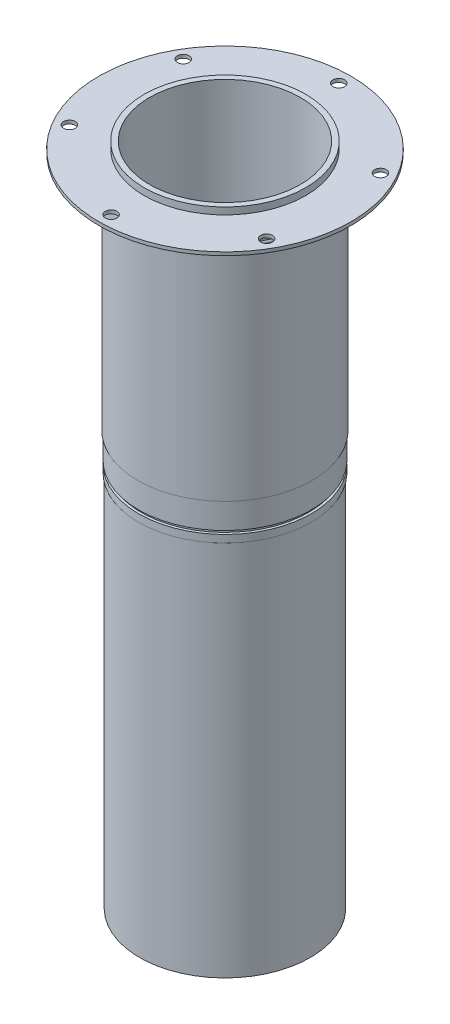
SolidWorks part; units mm, degrees
ref_plane "Front Plane" through (0, 0, 0) normal (0, 0, 1) x (1, 0, 0)
ref_plane "Top Plane" through (0, 0, 0) normal (0, 1, 0) x (1, 0, 0)
ref_plane "Right Plane" through (0, 0, 0) normal (1, 0, 0) x (0, 0, -1)
sketch "Sketch1" plane through (0, 0, 0) normal (0, 0, 1) x (1, 0, 0)
  line L0 (0, 0) -> (0, 40.0271) construction
  line L1 (-23.8125, 0) -> (-37.1348, 0)
  line L2 (-37.1348, 0) -> (-37.1348, -0.9906)
  line L3 (-25.654, -6.35) -> (-25.4, -6.35)
  line L4 (-37.1348, -0.9906) -> (-25.4, -0.9906)
  line L5 (-23.8125, 0) -> (-23.8125, 2.032)
  line L6 (-23.8125, 2.032) -> (-22.225, 2.032)
  line L7 (-22.225, 2.032) -> (-22.225, -193.675)
  line L8 (-22.225, -193.675) -> (-25.146, -193.675)
  line L9 (-25.146, -193.675) -> (-25.146, -82.55)
  line L10 (-25.4, -80.3656) -> (-24.6761, -80.3656)
  line L11 (-24.6761, -80.3656) -> (-24.6761, -79.375)
  line L12 (-24.6761, -79.375) -> (-25.4, -79.375)
  line L13 (-25.146, -82.55) -> (-25.4, -82.55)
  line L14 (-25.4, -82.55) -> (-25.4, -80.3656)
  line L15 (-25.4, -79.375) -> (-25.4, -71.755)
  line L16 (-25.4, -71.755) -> (-25.654, -71.755)
  line L19 (-25.654, -71.755) -> (-25.654, -6.35)
  line L20 (-25.4, -0.9906) -> (-25.4, -6.35)
  dimension "D2" = 6.35
  dimension "D3" = 44.45
  dimension "D4" = 47.625
  dimension "D5" = 2.032
  dimension "D6" = 50.8
  dimension "D7" = 7.62
  dimension "D8" = 50.292
  dimension "D9" = 79.375
  dimension "D10" = 193.675
  dimension "D11" = 51.308
  dimension "D12" = 82.55
  dimension "D13" = 0.9906
  dimension "D14" = 50.8
  dimension "D15" = 49.3522
  dimension "D16" = 0.9906
  dimension "D17" = 74.2696
revolve "Revolve1" add sketch "Sketch1" angle 360 about L0
hole_wizard "#8-32 Tapped Hole1" positions "Sketch8" profile "Sketch7" tap size "#8-32" standard "ANSI Inch"
sketch "Sketch8" plane through (0, 0, 0) normal (0, 1, 0) x (1, 0, 0)
  line L0 (0, -28.575) -> (0, 0) construction
  point P0 (0, -28.575)
  dimension "D1" = 28.575
sketch "Sketch7" plane through (0, 0, 28.575) normal (1, 0, 0) x (0, 0, 1)
  line L0 (0, 0) -> (0, 12.446)
  line L1 (0, 12.446) -> (1.7272, 12.446)
  line L2 (1.7272, 12.446) -> (1.7272, 0)
  line L5 (1.7272, 0) -> (0, 0)
  line L10 (0, 12.446) -> (-1.7272, 12.446) construction
  line L11 (0, -6.35) -> (0, 107.95) construction
  dimension "Tap Drill Dia." = 3.4544
  dimension "Tap Drill Depth" = 12.446
  dimension "Drill Angle" = 180
hole_wizard "#8-32 Tapped Hole2" positions "Sketch10" profile "Sketch9" tap size "#8-32" standard "ANSI Inch"
sketch "Sketch10" plane through (0, 0, 0) normal (0, 1, 0) x (1, 0, 0)
  line L0 (0, -39.37) -> (0, 0) construction
  line L1 (0, 0) -> (29.0361, -16.764) construction
  point P0 (29.0361, -16.764)
  dimension "D1" = 33.528
  dimension "D2" = 60
sketch "Sketch9" plane through (29.0361, 0, 16.764) normal (1, 0, 0) x (0, 0, 1)
  line L0 (0, 0) -> (0, 10.668)
  line L1 (0, 10.668) -> (1.7272, 10.668)
  line L2 (1.7272, 10.668) -> (1.7272, 0)
  line L5 (1.7272, 0) -> (0, 0)
  line L10 (0, 10.668) -> (-1.7272, 10.668) construction
  line L11 (0, -6.35) -> (0, 107.95) construction
  dimension "Tap Drill Dia." = 3.4544
  dimension "Tap Drill Depth" = 10.668
  dimension "Drill Angle" = 180
fillet "Fillet1" radius 0.762 1 edges at (0, -6.35, -25.654)
sketch "Sketch11" plane through (0, 0, 0) normal (0, 1, 0) x (1, 0, 0)
  line L0 (20.7873, -22.2917) -> (0, 0) construction
  line L1 (0, 0) -> (8.9115, -29.1482) construction
  line L2 (0, 0) -> (0, -42.7723) construction
  line L3 (0, 0) -> (29.0361, -16.764) construction
  line L4 (0, -30.48) -> (26.3965, -15.24) construction
  line L5 (17.6276, -30.5319) -> (13.1982, -22.86) construction
  arc A0 (24.044, -25.784) -> (17.5306, -18.7993) centre (20.7873, -22.2917) ccw
  arc A1 (10.3076, -33.7147) -> (24.044, -25.784) centre (0, 0) ccw
  circle A2 centre (0, 0) radius 30.48 construction
  arc A3 (7.5154, -24.5816) -> (10.3076, -33.7147) centre (8.9115, -29.1482) ccw
  arc A4 (7.5154, -24.5816) -> (17.5306, -18.7993) centre (0, 0) ccw
  dimension "D1" = 4.7752
  dimension "D2" = 60.96
  dimension "D4" = 26
extrude "Cut-Extrude1" [suppressed] cut sketch "Sketch11" against normal up to next
pattern_circular "CirPattern1" count 6 over 360 about axis through (0, 0, 0) along (0, 1, 0) of "#8-32 Tapped Hole2"
pattern_circular "CirPattern2" [suppressed] count 6 over 360
